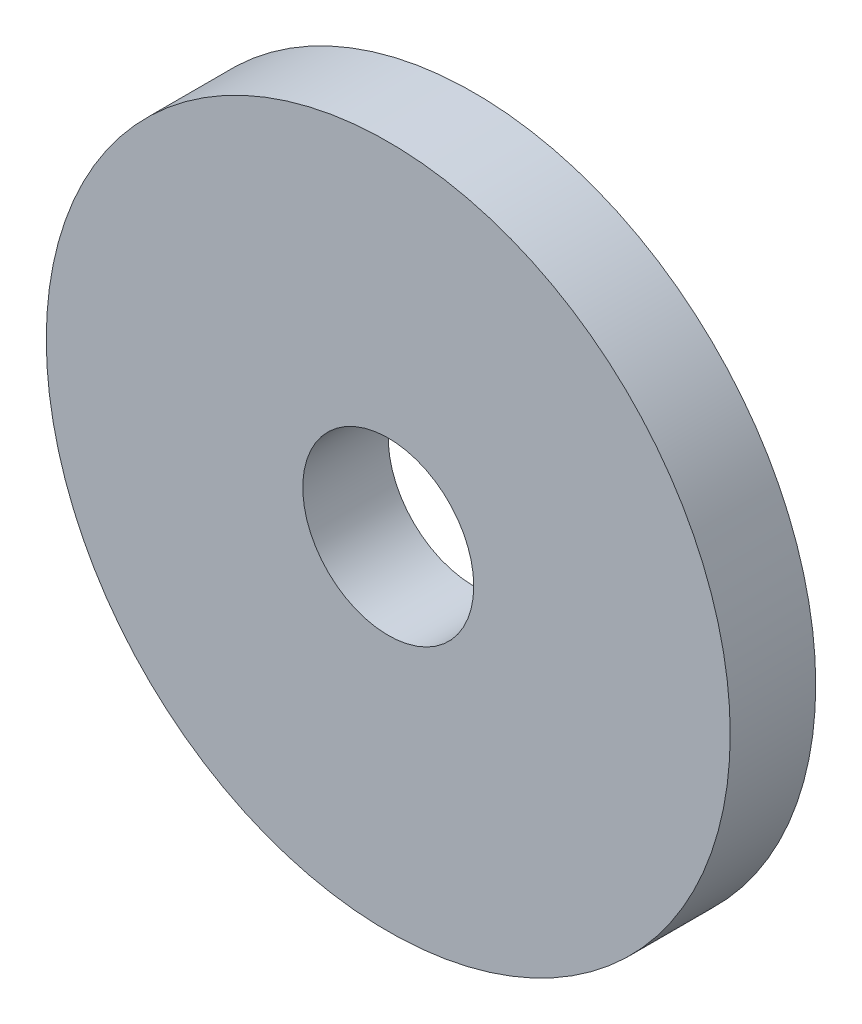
SolidWorks part; units mm, degrees
ref_plane "Front Plane" through (0, 0, 0) normal (0, 0, 1) x (1, 0, 0)
ref_plane "Top Plane" through (0, 0, 0) normal (0, 1, 0) x (1, 0, 0)
ref_plane "Right Plane" through (0, 0, 0) normal (1, 0, 0) x (0, 0, -1)
sketch "Sketch1" plane through (0, 0, 0) normal (0, 0, 1) x (1, 0, 0)
  circle A0 centre (0, 0) radius 12.7
  circle A1 centre (0, 0) radius 3.175
extrude "Boss-Extrude1" add sketch "Sketch1" along normal blind 3.175
